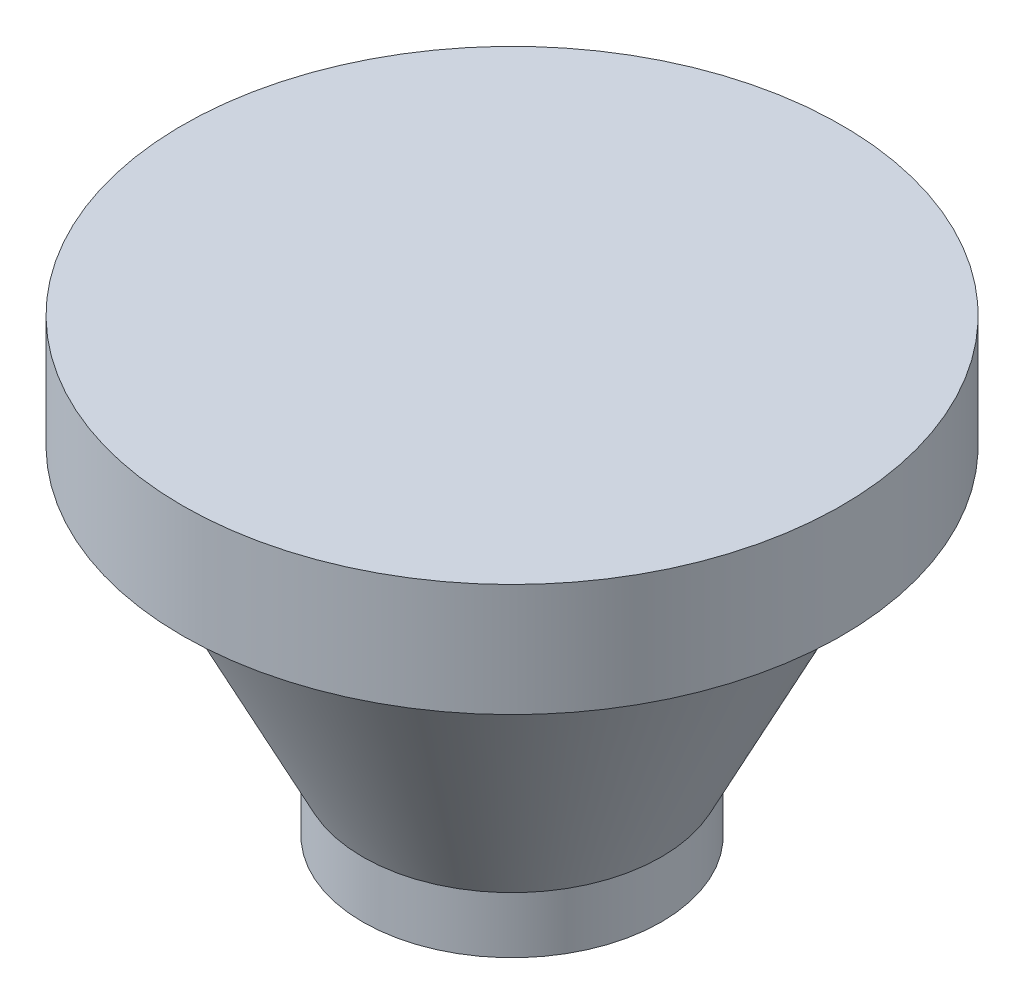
SolidWorks part; units mm, degrees
ref_plane "Front Plane" through (0, 0, 0) normal (0, 0, 1) x (1, 0, 0)
ref_plane "Top Plane" through (0, 0, 0) normal (0, 1, 0) x (1, 0, 0)
ref_plane "Right Plane" through (0, 0, 0) normal (1, 0, 0) x (0, 0, -1)
sketch "Sketch1" plane through (0, 0, 0) normal (1, 0, 0) x (0, 0, -1)
  line L0 (0, 0) -> (5.3, 0)
  line L1 (5.3, 0) -> (5.3, 2)
  line L2 (5.3, 2) -> (10.3, 12)
  line L3 (10.3, 12) -> (11.7, 12)
  line L4 (11.7, 12) -> (11.7, 16)
  line L5 (11.7, 16) -> (0, 16)
  line L6 (0, 16) -> (0, 0)
  dimension "D1" = 2
  dimension "D2" = 4
  dimension "D3" = 5.3
  dimension "D4" = 11.7
  dimension "D5" = 16
  dimension "D6" = 1.4
revolve "Revolve2" add sketch "Sketch1" angle 360 about L6
